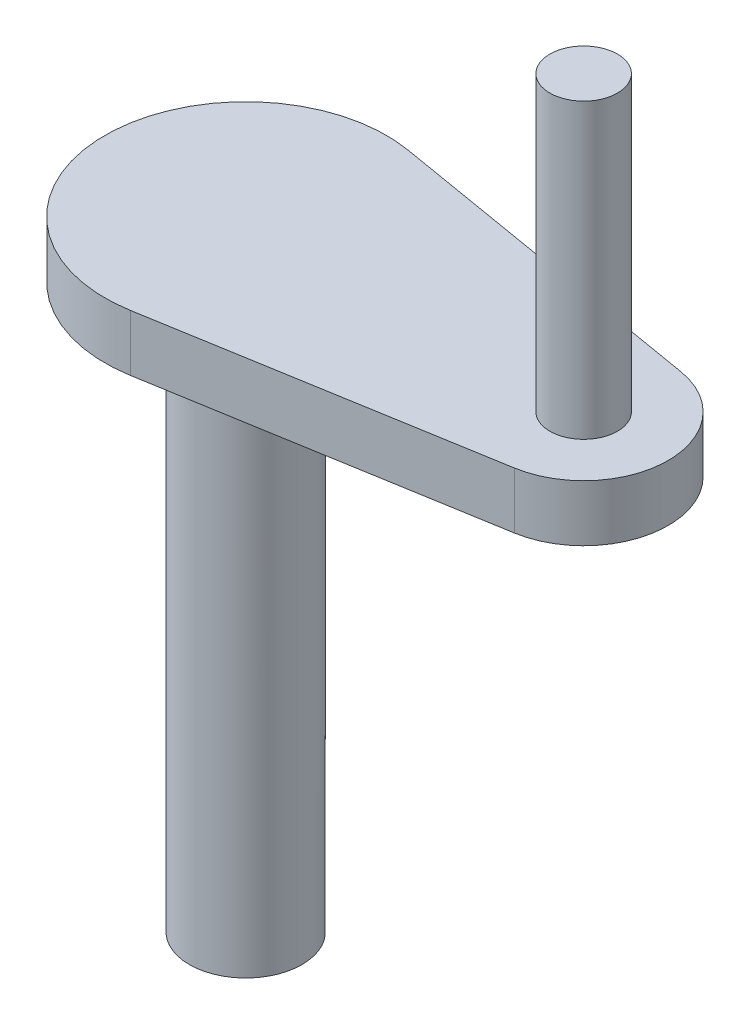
SolidWorks part; units mm, degrees
ref_plane "Ebene vorne" through (0, 0, 0) normal (0, 0, 1) x (1, 0, 0)
ref_plane "Ebene oben" through (0, 0, 0) normal (0, 1, 0) x (1, 0, 0)
ref_plane "Ebene rechts" through (0, 0, 0) normal (1, 0, 0) x (0, 0, -1)
sketch "Skizze1" plane through (0, 0, 0) normal (0, 0, 1) x (1, 0, 0)
sketch_block_instance "Kurbel-1"
sketch_block "Kurbel" parameters "D1"=20, "D2"=96.1163, "D3"=24.7372, "D4"=17.9209, "D5"=10, "D6"=10
ref_plane "Ebene4" through (0, 90.3761, 0) normal (0, 1, 0) x (-1, 0, 0)
sketch "Skizze2" plane through (0, 90.3761, 0) normal (0, 1, 0) x (-1, 0, 0)
  line L0 (32.1403, 0) -> (12.1403, 0) construction
  line L1 (-40.3597, 14.7902) -> (17.9737, 24.6503)
  line L2 (47.1403, 0) -> (-52.8597, 0)
  line L3 (-40.3597, -14.7902) -> (17.9737, -24.6503)
  arc A0 (17.9737, -24.6503) -> (17.9737, 24.6503) centre (22.1403, 0) ccw
  arc A1 (-40.3597, -14.7902) -> (-40.3597, 14.7902) centre (-37.8597, 0) cw
extrude "Linear austragen1" add sketch "Skizze2" along normal blind 10 contours A1 L2 A0 L1 | A1 L3 A0 L2
sketch "Skizze3" plane through (0, 100.3761, 0) normal (0, 1, 0) x (-1, 0, 0)
  circle A0 centre (-37.8597, 0) radius 6
  dimension "D1" = 12
extrude "Linear austragen2" add sketch "Skizze3" along normal blind 52
sketch "Skizze4" plane through (0, 90.3761, 0) normal (0, -1, 0) x (1, 0, 0)
  circle A0 centre (-22.1403, 0) radius 10
extrude "Linear austragen3" add sketch "Skizze4" along normal up to vertex (100 mm away)
sketch "Skizze5" plane through (0, 90.3761, 0) normal (0, -1, 0) x (1, 0, 0)
  circle A0 centre (-22.1403, 0) radius 10 construction
  circle A1 centre (-22.1403, 0) radius 10
curve "Spirale/Helix1"
sketch "Skizze7" plane through (0, 90.3761, 0) normal (0, -1, 0) x (1, 0, 0)
  line L0 (-22.1403, 10) -> (-22.1403, 20)
  circle A0 centre (-22.1403, 0) radius 10 construction
  dimension "D1" = 10
surface "Oberfläche-Austragung1"
